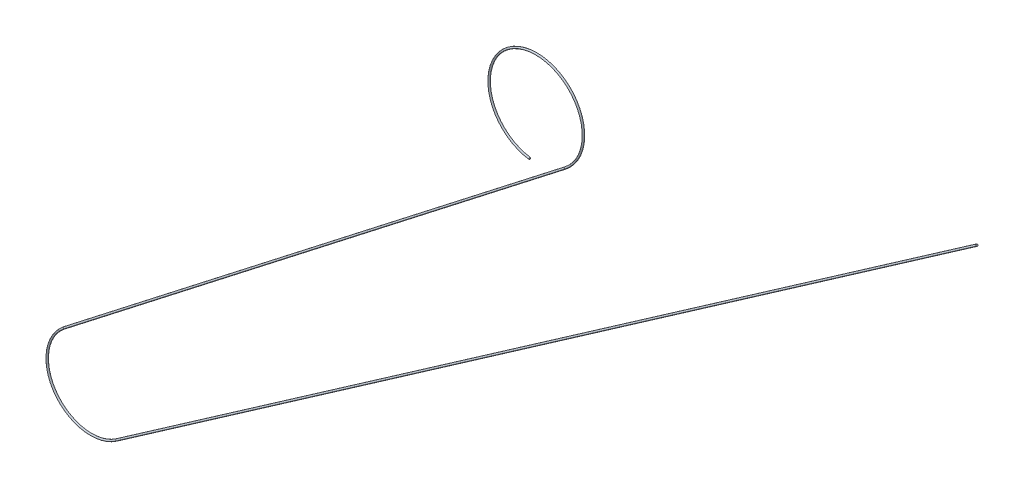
SolidWorks part; units mm, degrees
ref_plane "Plan de face" through (0, 0, 0) normal (0, 0, 1) x (1, 0, 0)
ref_plane "Plan de dessus" through (0, 0, 0) normal (0, 1, 0) x (1, 0, 0)
ref_plane "Plan de droite" through (0, 0, 0) normal (1, 0, 0) x (0, 0, -1)
sketch "Esquisse1" plane through (1828.7162, 1046.4239, 0) normal (0, 0, 1) x (-0.5713, 0.8207, 0)
  line L0 (185.9591, 5072.6699) -> (185.9591, 2098.7199)
  line L3 (435.7899, 5079.1704) -> (529.3395, 3282.711)
  arc A0 (435.7899, 5079.1704) -> (185.9591, 5072.6699) centre (310.9591, 5072.6699) ccw
  arc A5 (529.3395, 3282.711) -> (564.7634, 3380.5546) centre (662.9585, 3289.6691) ccw
  dimension "D1" = 125
  dimension "D2" = 476.9994
  dimension "D3" = 1190.9492
  dimension "D4" = 133.8
  dimension "D11" = 2973.95
ref_plane "Plan1" through (0, 0, 0) normal (0.8207, 0.5713, 0) x (0, 0, -1)
sketch "Esquisse2" plane through (0, 0, 0) normal (0.8207, 0.5713, 0) x (0, 0, -1)
  circle A0 centre (0, 0) radius 2.5
  dimension "D1" = 5
sweep "Balayage1" add profiles "Esquisse2" path "Esquisse1"
